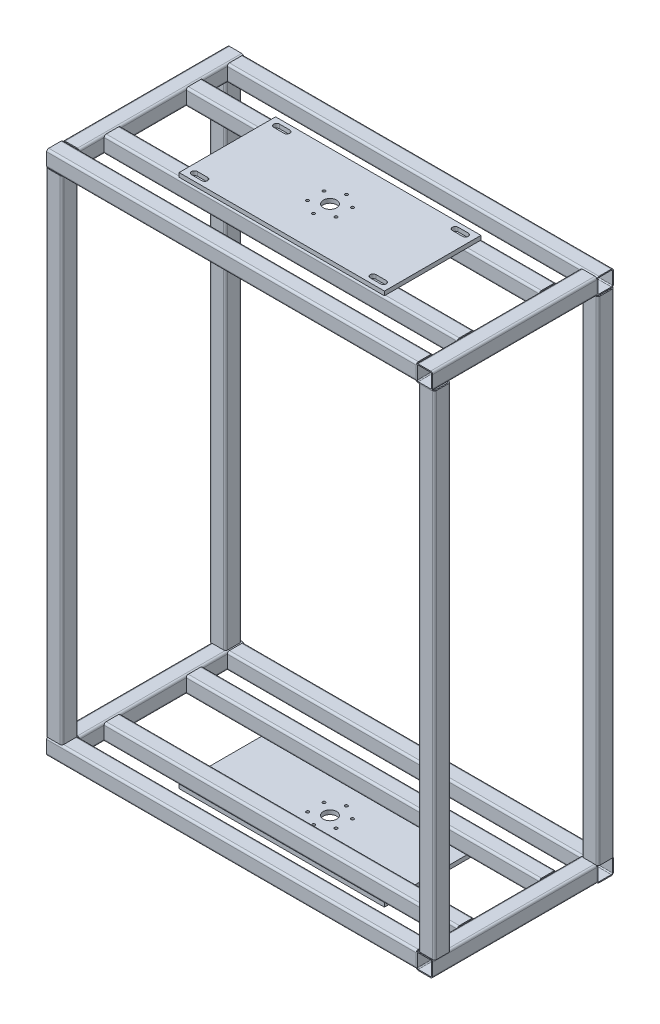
SolidWorks part; units mm, degrees
ref_plane "Front Plane" through (0, 0, 0) normal (0, 0, 1) x (1, 0, 0)
ref_plane "Top Plane" through (0, 0, 0) normal (0, 1, 0) x (1, 0, 0)
ref_plane "Right Plane" through (0, 0, 0) normal (1, 0, 0) x (0, 0, -1)
sketch "Sketch1" plane through (0, 0, 0) normal (0, 1, 0) x (1, 0, 0)
  line L0 (-900, -200) -> (900, -200)
  line L1 (-900, 400) -> (900, 400)
  line L2 (-900, 400) -> (-900, -400)
  line L3 (-900, -400) -> (900, -400)
  line L4 (900, 400) -> (900, -400)
  line L5 (-900, 400) -> (900, -400) construction
  line L6 (-900, -400) -> (900, 400) construction
  line L7 (0, 0) -> (452.7023, 0) construction
  line L8 (-900, 200) -> (900, 200)
  point P0 (0, 0)
  dimension "D1" = 1800
  dimension "D2" = 800
  dimension "D3" = 200
other "Square tube 80 X 80 X 5(1)"
ref_plane "Plane1" through (-900, 0, -400) normal (0, 0, 1) x (1, 0, 0)
sketch "Sketch11" plane through (-900, 0, -400) normal (0, 0, 1) x (1, 0, 0)
  line L0 (-30, -35) -> (30, -35)
  line L1 (-35, -30) -> (-35, 30)
  line L2 (30, 35) -> (-30, 35)
  line L3 (35, 30) -> (35, -30)
  line L4 (-30, -40) -> (30, -40)
  line L5 (-40, -30) -> (-40, 30)
  line L6 (30, 40) -> (-30, 40)
  line L7 (40, 30) -> (40, -30)
  arc A0 (40, 30) -> (30, 40) centre (30, 30) ccw
  arc A1 (30, -40) -> (40, -30) centre (30, -30) ccw
  arc A2 (-40, -30) -> (-30, -40) centre (-30, -30) ccw
  arc A3 (-30, 40) -> (-40, 30) centre (-30, 30) ccw
  arc A4 (-30, 35) -> (-35, 30) centre (-30, 30) ccw
  arc A5 (35, 30) -> (30, 35) centre (30, 30) ccw
  arc A6 (30, -35) -> (35, -30) centre (30, -30) ccw
  arc A7 (-35, -30) -> (-30, -35) centre (-30, -30) ccw
  point P0 (-40, 0)
  point P1 (40, 0)
  point P2 (0, 40)
  point P3 (0, -40)
  point P4 (0, 0)
  point P5 (-40, -40)
  point P6 (40, -40)
  point P7 (40, 40)
  point P8 (-40, 40)
  point P33 (0, 0)
  dimension "D1" = 10
  dimension "Thickness" = 5
  dimension "V_leg" = 80
sketch "Sketch13" plane through (0, 40, 0) normal (0, 1, 0) x (1, 0, 0)
  line L0 (860, -235) -> (-860, -235) construction
  line L1 (-500, 235) -> (500, 235)
  line L2 (-500, 235) -> (-500, -235)
  line L3 (-500, -235) -> (500, -235)
  line L4 (500, 235) -> (500, -235)
  line L5 (-500, 235) -> (500, -235) construction
  line L6 (-500, -235) -> (500, 235) construction
  point P0 (0, 0)
  dimension "D1" = 1000
extrude "Boss-Extrude2" add sketch "Sketch13" along normal blind 20 separate body
sketch "Sketch14" plane through (0, 60, 0) normal (0, 1, 0) x (1, 0, 0)
  line L0 (-460, 200) -> (-410, 200) construction
  line L1 (-900, 200) -> (900, 200) construction
  line L2 (-460, 214) -> (-410, 214)
  line L3 (-460, 186) -> (-410, 186)
  line L4 (-500, 235) -> (-500, -235) construction
  line L5 (0, 0) -> (50000, 0) construction
  line L6 (0, 0) -> (0, 50000) construction
  line L7 (-460, -200) -> (-410, -200) construction
  line L8 (-460, -214) -> (-410, -214)
  line L9 (-460, -186) -> (-410, -186)
  line L10 (460, -200) -> (410, -200) construction
  line L11 (460, -214) -> (410, -214)
  line L12 (460, -186) -> (410, -186)
  line L13 (460, 200) -> (410, 200) construction
  line L14 (460, 214) -> (410, 214)
  line L15 (460, 186) -> (410, 186)
  circle A0 centre (0, 0) radius 32.5
  circle A1 centre (0, 0) radius 80 construction
  circle A2 centre (0, 80) radius 7
  circle A3 centre (69.282, 40) radius 7
  circle A4 centre (69.282, -40) radius 7
  circle A5 centre (0, -80) radius 7
  circle A6 centre (-69.282, -40) radius 7
  circle A7 centre (-69.282, 40) radius 7
  arc A8 (-460, 214) -> (-460, 186) centre (-460, 200) ccw
  arc A9 (-410, 186) -> (-410, 214) centre (-410, 200) ccw
  arc A10 (-460, -214) -> (-460, -186) centre (-460, -200) cw
  arc A11 (-410, -186) -> (-410, -214) centre (-410, -200) cw
  arc A12 (460, -214) -> (460, -186) centre (460, -200) ccw
  arc A13 (410, -186) -> (410, -214) centre (410, -200) ccw
  arc A14 (460, 214) -> (460, 186) centre (460, 200) cw
  arc A15 (410, 186) -> (410, 214) centre (410, 200) cw
  point P18 (0, 0)
  point P21 (-435, 200)
  point P34 (-435, -200)
  point P41 (435, -200)
  point P48 (435, 200)
  point P53 (0, 0)
  point P54 (0, 0)
  point P55 (0, 0)
  dimension "D1" = 65
  dimension "D2" = 160
  dimension "D3" = 14
  dimension "D5" = 14
  dimension "D6" = 50
  dimension "D7" = 40
  dimension "D4" = 6
extrude "Cut-Extrude1" cut sketch "Sketch14" against normal up to surface (20 mm away)
sketch3d "3DSketch1"
  line L0 (907.0678, -39.3318, -398.2526) -> (907.0678, -2439.3318, -398.2526)
  line L3 (-900, 0, 400) -> (900, 0, -400) construction
  line L4 (900, 0, -400) -> (900, 0, 400) construction
  point P2 (0, 0, 0)
  point P3 (0, 0, 0)
  point P4 (0, 0, 0)
  point P5 (0, 0, 0)
  point P6 (913.3381, -41.719, -399.1273)
  point P7 (0, 0, 0)
  point P8 (0, 0, 0)
  point P9 (0, 0, 0)
  point P10 (900, 0, -400)
  point P11 (907.7407, -43.0763, -398.0862)
  dimension "D1" = 2400
  dimension "D2" = 40
ref_plane "Plane2" through (0, 0, 0) normal (1, 0, 0) x (0, 0, -1)
ref_plane "Plane3" through (0, 0, 0) normal (0, 0, 1) x (1, 0, 0)
other "Square tube 80 X 80 X 5(2)"
ref_plane "Plane4" through (907.0678, -39.3318, -398.2526) normal (0, -1, 0) x (1, 0, 0)
sketch "Sketch12" plane through (907.0678, -39.3318, -398.2526) normal (0, -1, 0) x (1, 0, 0)
  line L0 (-30, -35) -> (30, -35)
  line L1 (-35, -30) -> (-35, 30)
  line L2 (30, 35) -> (-30, 35)
  line L3 (35, 30) -> (35, -30)
  line L4 (-30, -40) -> (30, -40)
  line L5 (-40, -30) -> (-40, 30)
  line L6 (30, 40) -> (-30, 40)
  line L7 (40, 30) -> (40, -30)
  arc A0 (40, 30) -> (30, 40) centre (30, 30) ccw
  arc A1 (30, -40) -> (40, -30) centre (30, -30) ccw
  arc A2 (-40, -30) -> (-30, -40) centre (-30, -30) ccw
  arc A3 (-30, 40) -> (-40, 30) centre (-30, 30) ccw
  arc A4 (-30, 35) -> (-35, 30) centre (-30, 30) ccw
  arc A5 (35, 30) -> (30, 35) centre (30, 30) ccw
  arc A6 (30, -35) -> (35, -30) centre (30, -30) ccw
  arc A7 (-35, -30) -> (-30, -35) centre (-30, -30) ccw
  point P0 (-40, 0)
  point P1 (40, 0)
  point P2 (0, 40)
  point P3 (0, -40)
  point P4 (0, 0)
  point P5 (-40, -40)
  point P6 (40, -40)
  point P7 (40, 40)
  point P8 (-40, 40)
  point P33 (0, 0)
  dimension "D1" = 10
  dimension "Thickness" = 5
  dimension "V_leg" = 80
mirror "Mirror1" about plane through (0, 0, 0) normal (1, 0, 0)
ref_plane "Plane5" through (0, -1239.3318, 0) normal (0, -1, 0) x (-1, 0, 0)
mirror "Mirror2" about plane through (0, -1239.3318, 0) normal (0, -1, 0)
